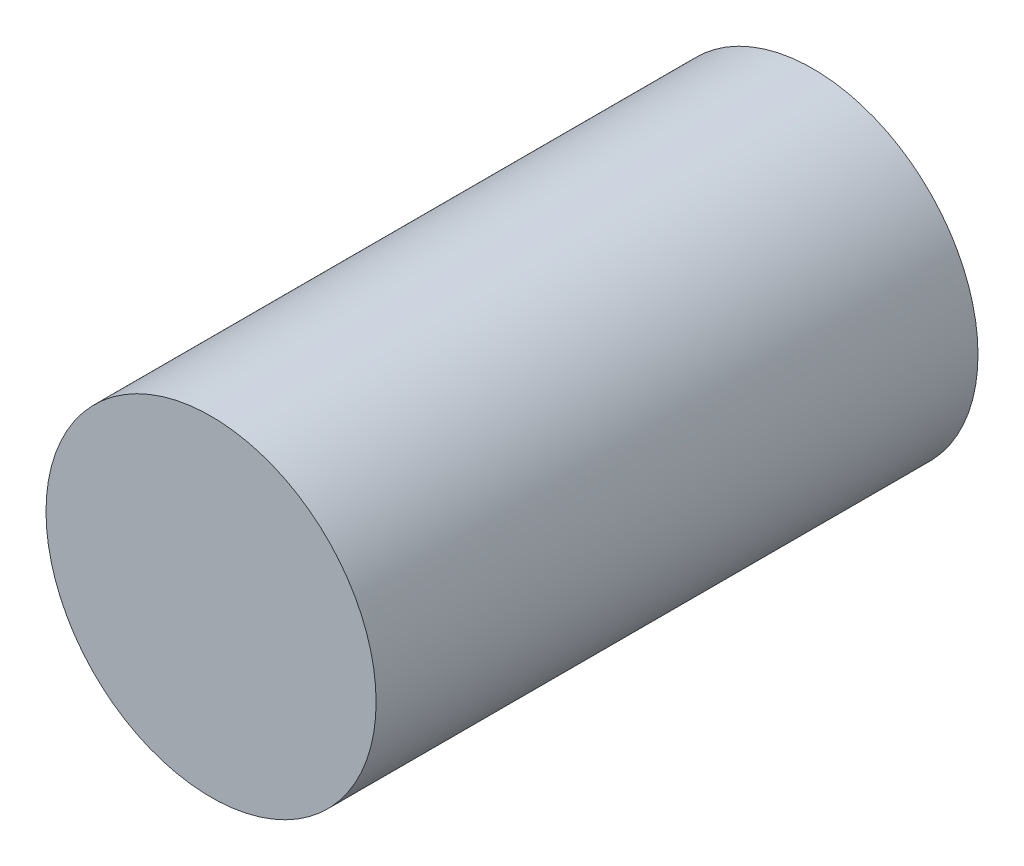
SolidWorks part; units mm, degrees
ref_plane "Plan de face" through (0, 0, 0) normal (0, 0, 1) x (1, 0, 0)
ref_plane "Plan de dessus" through (0, 0, 0) normal (0, 1, 0) x (1, 0, 0)
ref_plane "Plan de droite" through (0, 0, 0) normal (1, 0, 0) x (0, 0, -1)
sketch "Esquisse1" plane through (0, 0, 0) normal (0, 0, 1) x (1, 0, 0)
  circle A0 centre (0, 0) radius 16.1787 construction
  circle A1 centre (0, 0) radius 16.1787
extrude "Boss.-Extru.1" add sketch "Esquisse1" against normal up to surface (59 mm away) contours A1
